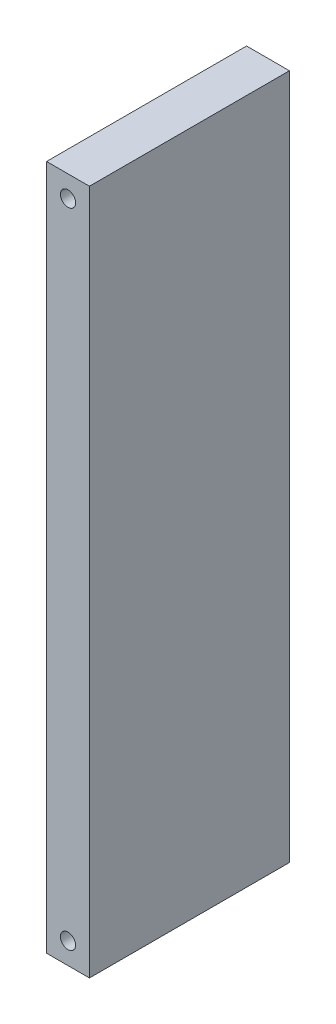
SolidWorks part; units mm, degrees
ref_plane "Front" through (0, 0, 0) normal (0, 0, 1) x (1, 0, 0)
ref_plane "Top" through (0, 0, 0) normal (0, 1, 0) x (1, 0, 0)
ref_plane "Right" through (0, 0, 0) normal (1, 0, 0) x (0, 0, -1)
sketch "Sketch1" plane through (0, 0, 0) normal (0, 0, 1) x (1, 0, 0)
  line L0 (-1219.2, -304.8) -> (0, -304.8) construction
  line L1 (-228.6, 304.8) -> (-266.7, 304.8)
  line L2 (-228.6, 304.8) -> (-228.6, -304.8)
  line L3 (-228.6, -304.8) -> (-266.7, -304.8)
  line L4 (-266.7, 304.8) -> (-266.7, -304.8)
  line L5 (0, 304.8) -> (-1219.2, 304.8) construction
  line L6 (-50.8, 304.8) -> (-50.8, -304.8) construction
  dimension "D1" = 38.1
  dimension "D2" = 177.8
extrude "Boss-Extrude1" add sketch "Sketch1" along normal blind 177.8 separate body
ref_plane "Plane1" through (-247.65, 0, 0) normal (1, 0, 0) x (0, 0, -1)
hole_wizard "Hole1" positions "Point_Sketch" profile "Profil_Sketch" tap size "5/8-11" standard "ANSI Inch"
sketch "Point_Sketch" plane through (-261.8635, -301.9822, 177.8) normal (0, 0, 1) x (1, 0, 0)
  point P0 (14.2135, 16.2322)
  point P2 (14.2135, 587.7322)
sketch "Profil_Sketch" plane through (-247.65, -285.75, 177.8) normal (1, 0, 0) x (0, -1, 0)
  line L0 (0, 0) -> (0, 59.6803)
  line L1 (0, 59.6803) -> (6.7475, 55.626)
  line L2 (6.7475, 55.626) -> (6.7475, 0)
  line L5 (6.7475, 0) -> (0, 0)
  line L10 (0, 59.6803) -> (-6.7475, 55.626) construction
  line L11 (0, -6.35) -> (0, 107.95) construction
  dimension "Tap Drill Dia." = 13.495
  dimension "Tap Drill Depth" = 55.626
  dimension "Drill Angle" = 118
other "usin_TS240_.625-11x3.5-SHCS<1>"
